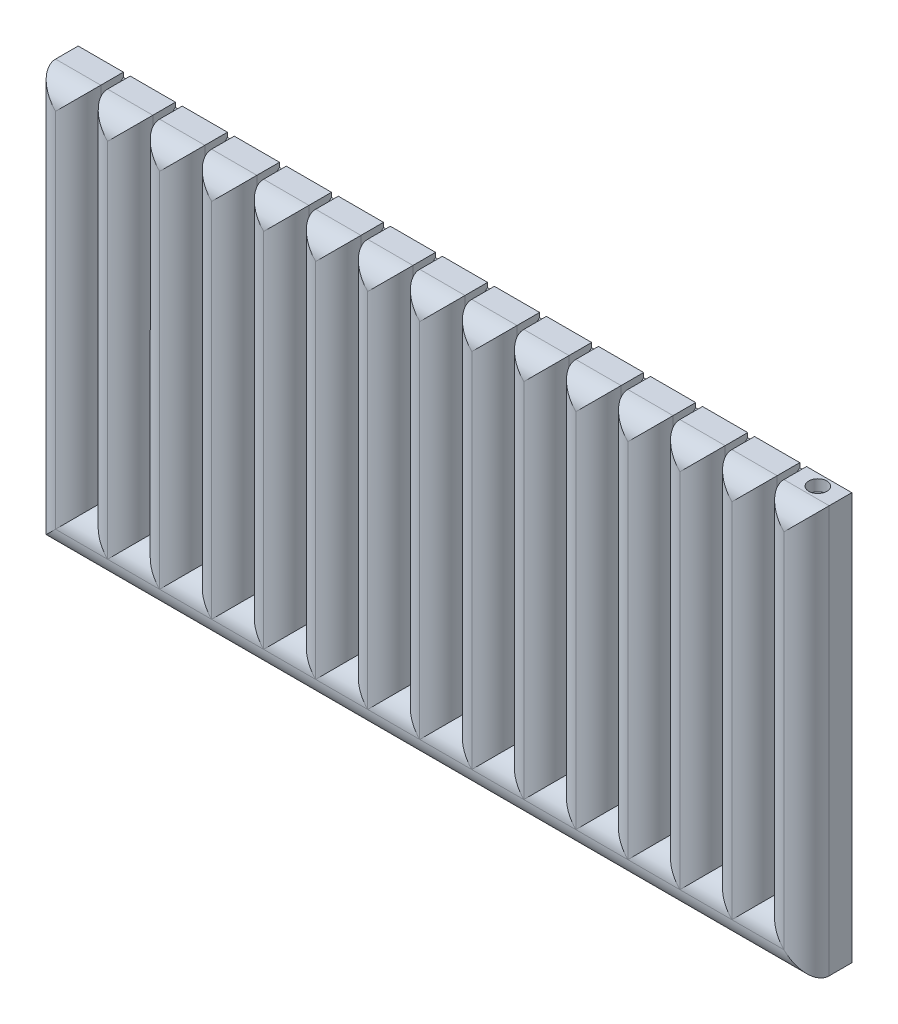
SolidWorks part; units mm, degrees
ref_plane "Front Plane" through (0, 0, 0) normal (0, 0, 1) x (1, 0, 0)
ref_plane "Top Plane" through (0, 0, 0) normal (0, 1, 0) x (1, 0, 0)
ref_plane "Right Plane" through (0, 0, 0) normal (1, 0, 0) x (0, 0, -1)
sketch "Sketch1" plane through (0, 0, 0) normal (0, 0, 1) x (1, 0, 0)
  line L1 (0, 0) -> (342, 0)
  line L2 (0, 0) -> (0, 180)
  line L3 (0, 180) -> (342, 180)
  line L4 (342, 0) -> (342, 180)
  dimension "D1" = 180
  dimension "D2" = 342
extrude "Extrude1" add sketch "Sketch1" along normal blind 20
sketch "Sketch2" plane through (0, 0, 20) normal (0, 0, 1) x (1, 0, 0)
  line L0 (342, 180) -> (0, 180) construction
  line L1 (20, 180) -> (23, 180)
  line L2 (20, 180) -> (20, 20)
  line L3 (20, 20) -> (23, 20)
  line L4 (23, 180) -> (23, 20)
  line L5 (0, 180) -> (0, 0) construction
  line L58 (43, 180) -> (46, 180)
  line L59 (43, 180) -> (43, 20)
  line L60 (46, 180) -> (46, 20)
  line L61 (43, 20) -> (46, 20)
  line L62 (66, 180) -> (69, 180)
  line L63 (66, 180) -> (66, 20)
  line L64 (69, 180) -> (69, 20)
  line L65 (66, 20) -> (69, 20)
  line L66 (89, 180) -> (92, 180)
  line L67 (89, 180) -> (89, 20)
  line L68 (92, 180) -> (92, 20)
  line L69 (89, 20) -> (92, 20)
  line L70 (112, 180) -> (115, 180)
  line L71 (112, 180) -> (112, 20)
  line L72 (115, 180) -> (115, 20)
  line L73 (112, 20) -> (115, 20)
  line L74 (135, 180) -> (138, 180)
  line L75 (135, 180) -> (135, 20)
  line L76 (138, 180) -> (138, 20)
  line L77 (135, 20) -> (138, 20)
  line L78 (158, 180) -> (161, 180)
  line L79 (158, 180) -> (158, 20)
  line L80 (161, 180) -> (161, 20)
  line L81 (158, 20) -> (161, 20)
  line L82 (181, 180) -> (184, 180)
  line L83 (181, 180) -> (181, 20)
  line L84 (184, 180) -> (184, 20)
  line L85 (181, 20) -> (184, 20)
  line L86 (204, 180) -> (207, 180)
  line L87 (204, 180) -> (204, 20)
  line L88 (207, 180) -> (207, 20)
  line L89 (204, 20) -> (207, 20)
  line L90 (227, 180) -> (230, 180)
  line L91 (227, 180) -> (227, 20)
  line L92 (230, 180) -> (230, 20)
  line L93 (227, 20) -> (230, 20)
  line L94 (250, 180) -> (253, 180)
  line L95 (250, 180) -> (250, 20)
  line L96 (253, 180) -> (253, 20)
  line L97 (250, 20) -> (253, 20)
  line L98 (273, 180) -> (276, 180)
  line L99 (273, 180) -> (273, 20)
  line L100 (276, 180) -> (276, 20)
  line L101 (273, 20) -> (276, 20)
  line L102 (296, 180) -> (299, 180)
  line L103 (296, 180) -> (296, 20)
  line L104 (299, 180) -> (299, 20)
  line L105 (296, 20) -> (299, 20)
  line L106 (319, 180) -> (322, 180)
  line L107 (319, 180) -> (319, 20)
  line L108 (322, 180) -> (322, 20)
  line L109 (319, 20) -> (322, 20)
  dimension "D1" = 20
  dimension "D2" = 160
  dimension "D3" = 3
extrude "Cut-Extrude1" cut sketch "Sketch2" against normal blind 16
fillet "Fillet1" radius 10 74 edges at (319, 100, 20) (320.5, 20, 20) (322, 100, 20) (320.5, 180, 4) (296, 100, 20) (297.5, 20, 20) (299, 100, 20) (297.5, 180, 4) (273, 100, 20) (274.5, 20, 20) (276, 100, 20) (274.5, 180, 4) (250, 100, 20) (251.5, 20, 20) (253, 100, 20) (251.5, 180, 4) (227, 100, 20) (228.5, 20, 20) (230, 100, 20) (228.5, 180, 4) (204, 100, 20) (205.5, 20, 20) (207, 100, 20) (205.5, 180, 4) (181, 100, 20) (182.5, 20, 20) (184, 100, 20) (182.5, 180, 4) (158, 100, 20) (159.5, 20, 20) (161, 100, 20) (159.5, 180, 4) (135, 100, 20) (136.5, 20, 20) (138, 100, 20) (136.5, 180, 4) (112, 100, 20) (113.5, 20, 20) (115, 100, 20) (113.5, 180, 4) (89, 100, 20) (90.5, 20, 20) (92, 100, 20) (90.5, 180, 4) (66, 100, 20) (67.5, 20, 20) (69, 100, 20) (67.5, 180, 4) (43, 100, 20) (44.5, 20, 20) (46, 100, 20) (44.5, 180, 4) (20, 100, 20) (21.5, 20, 20) (23, 100, 20) (21.5, 180, 4) (0, 90, 20) (171, 0, 20) (342, 90, 20) (10, 180, 20) (33, 180, 20) (56, 180, 20) (79, 180, 20) (102, 180, 20) (125, 180, 20) (148, 180, 20) (171, 180, 20) (194, 180, 20) (217, 180, 20) (240, 180, 20) (263, 180, 20) (286, 180, 20) (309, 180, 20) (332, 180, 20)
sketch "Sketch3" plane through (0, 180, 0) normal (0, 1, 0) x (1, 0, 0)
  circle A0 centre (332, -5) radius 4
extrude "Extrude2" cut sketch "Sketch3" against normal blind 5
